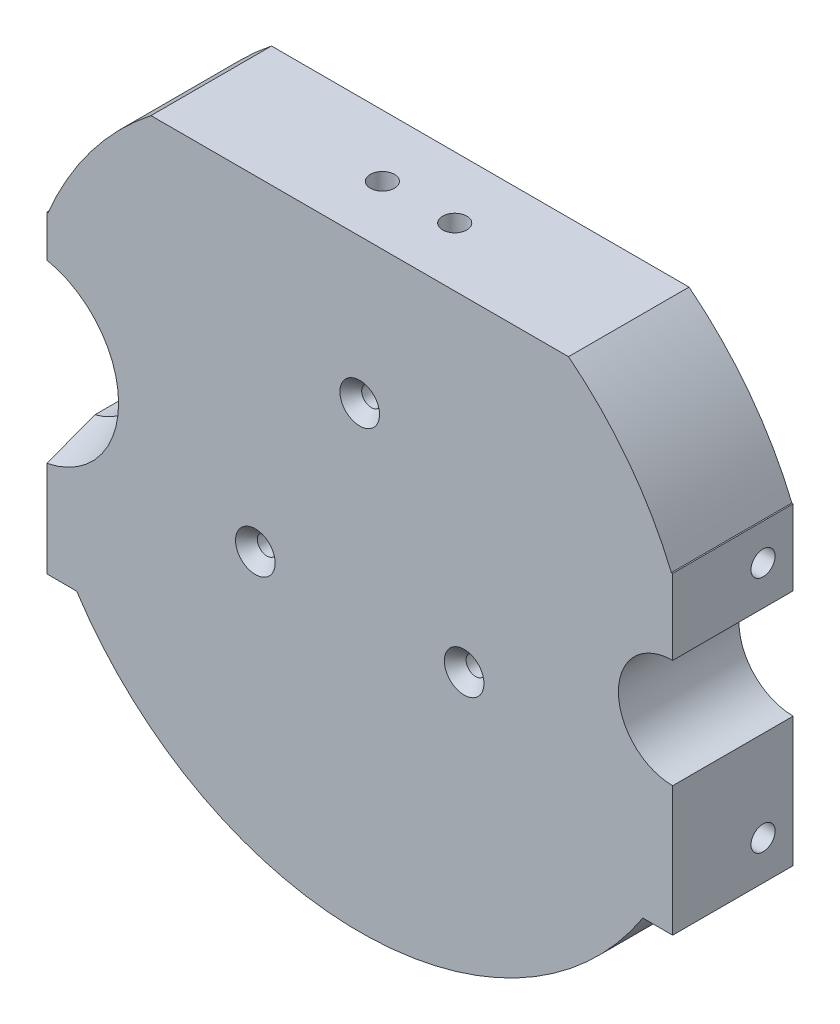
SolidWorks part; units mm, degrees
ref_plane "Front Plane" through (0, 0, 0) normal (0, 0, 1) x (1, 0, 0)
ref_plane "Top Plane" through (0, 0, 0) normal (0, 1, 0) x (1, 0, 0)
ref_plane "Right Plane" through (0, 0, 0) normal (1, 0, 0) x (0, 0, -1)
sketch "Sketch2" plane through (0, 0, 0) normal (0, 0, 1) x (1, 0, 0)
  line L0 (0, 0) -> (0, 82.931) construction
  line L1 (-82.423, -18.4451) -> (-82.423, -48.4124)
  line L2 (-82.423, 34.1376) -> (-82.0843, 34.1376)
  line L4 (91.948, -48.7934) -> (91.948, 34.1376) construction
  line L5 (82.0843, 34.1376) -> (82.423, 34.1376)
  line L6 (-91.948, -48.7934) -> (-91.948, 34.1376) construction
  line L7 (82.423, -14.3002) -> (82.423, -48.4124)
  line L9 (82.423, 34.1376) -> (82.423, 14.2748)
  line L10 (82.423, -48.4124) -> (74.5617, -48.4124)
  line L11 (-82.423, -48.4124) -> (-74.5617, -48.4124)
  line L12 (-82.423, 34.1376) -> (-82.423, 18.4451)
  arc A0 (82.0843, 34.1376) -> (-82.0843, 34.1376) centre (0, 0) ccw
  arc A1 (82.423, 14.2748) -> (82.423, -14.3002) centre (82.423, -0.0127) ccw
  arc A2 (-74.5617, -48.4124) -> (74.5617, -48.4124) centre (0, 0) ccw
  arc A3 (-82.423, -18.4451) -> (-82.423, 18.4451) centre (-87.1855, 0) ccw
  dimension "D4" = 177.8
  dimension "D7" = 14.2875
  dimension "D14" = 19.05
  dimension "D2" = 164.846
  dimension "D3" = 19.8628
  dimension "D5" = 34.1376
  dimension "D6" = 183.896
  dimension "D8" = 48.4124
  dimension "D9" = 82.423
  dimension "D10" = 82.423
  dimension "D11" = 91.948
  dimension "D12" = 91.948
  dimension "D13" = 82.55
  dimension "D15" = 87.1855
  dimension "D16" = 68.1355
  dimension "D17" = 68.1355
extrude "Boss-Extrude1" add sketch "Sketch2" against normal blind 31.75
hole_wizard "1/4 (0.25) Diameter Hole1" positions "Sketch11" profile "Sketch10" hole size "1/4" standard "ANSI Inch"
sketch "Sketch11" plane through (82.423, 0, 0) normal (1, 0, 0) x (0, 0, -1)
  line L0 (31.75, 34.1376) -> (0, 34.1376) construction
  line L2 (31.75, 34.1376) -> (31.75, 18.4451) construction
  line L3 (31.75, -48.4124) -> (0, -48.4124) construction
  point P0 (23.8125, 24.6126)
  point P4 (23.8125, -38.1)
  dimension "D1" = 7.9375
  dimension "D2" = 9.525
  dimension "D3" = 24.6126
  dimension "D4" = 62.7126
  dimension "D5" = 38.1
  dimension "D6" = 10.3124
sketch "Sketch10" plane through (82.423, 24.6126, -23.8125) normal (0, 1, 0) x (0, 0, -1)
  line L0 (0, 0) -> (0, 11.4327)
  line L1 (0, 11.4327) -> (3.175, 9.525)
  line L2 (3.175, 9.525) -> (3.175, 0)
  line L5 (3.175, 0) -> (0, 0)
  line L10 (0, 11.4327) -> (-3.175, 9.525) construction
  line L11 (0, -6.35) -> (0, 107.95) construction
  dimension "Hole Dia." = 6.35
  dimension "Hole Depth" = 9.525
  dimension "Drill Angle" = 118
hole_wizard "1/4 (0.25) Diameter Hole2" positions "Sketch13" profile "Sketch12" hole size "1/4" standard "ANSI Inch"
sketch "Sketch13" plane through (-82.423, 0, 0) normal (-1, 0, 0) x (0, 0, 1)
  line L1 (-31.75, 34.1376) -> (0, 34.1376) construction
  line L3 (-31.75, 34.1376) -> (-31.75, 18.4451) construction
  point P0 (-23.8125, -38.1)
  point P4 (-23.8125, 24.6126)
  dimension "D1" = 7.9375
  dimension "D2" = 62.7126
  dimension "D3" = 9.525
  dimension "D4" = 24.6126
  dimension "D5" = 38.1
sketch "Sketch12" plane through (-82.423, -38.1, -23.8125) normal (0, 1, 0) x (0, 0, 1)
  line L0 (0, 0) -> (0, 11.4327)
  line L1 (0, 11.4327) -> (3.175, 9.525)
  line L2 (3.175, 9.525) -> (3.175, 0)
  line L5 (3.175, 0) -> (0, 0)
  line L10 (0, 11.4327) -> (-3.175, 9.525) construction
  line L11 (0, -6.35) -> (0, 107.95) construction
  dimension "Hole Dia." = 6.35
  dimension "Hole Depth" = 9.525
  dimension "Drill Angle" = 118
sketch "Sketch18" plane through (0, 0, 0) normal (0, 0, 1) x (1, 0, 0)
  line L1 (127.4757, 125.8762) -> (-131.9061, 125.8762)
  line L2 (127.4757, 125.8762) -> (127.4757, 69.85)
  line L3 (127.4757, 69.85) -> (-131.9061, 69.85)
  line L4 (-131.9061, 125.8762) -> (-131.9061, 69.85)
  dimension "D1" = 69.85
extrude "Cut-Extrude4" cut sketch "Sketch18" against normal through all
sketch "Sketch19" plane through (0, 0, 0) normal (0, 1, 0) x (1, 0, 0)
  line L0 (0, 3.175) -> (-38.1, 3.175)
  line L1 (0, 3.175) -> (38.1, 3.175)
  line L2 (0, 3.175) -> (0, 0) construction
  line L3 (-38.1, 3.175) -> (-82.423, 0)
  line L4 (38.1, 3.175) -> (82.423, 0)
  line L5 (82.423, 0) -> (-82.423, 0)
  line L6 (-54.9926, 31.75) -> (54.9926, 31.75) construction
  line L7 (82.423, 0) -> (82.0843, 0) construction
  dimension "D1" = 38.1
  dimension "D2" = 164.846
  dimension "D3" = 3.175
  dimension "D4" = 28.575
hole_wizard "CSK for #10 Flat Head Socket Cap Screw1" positions "Sketch9" profile "Sketch8" countersink size "#10" standard "ANSI Inch"
sketch "Sketch9" plane through (64.8696, 88.3231, 0) normal (0, 0, 1) x (1, 0, 0)
  line L3 (-64.8696, -88.3231) -> (-64.8696, -56.5731) construction
  line L4 (-64.8696, -88.3231) -> (-37.3733, -104.1981) construction
  line L5 (-64.8696, -88.3231) -> (-92.3659, -104.1981) construction
  circle A1 centre (-64.8696, -88.3231) radius 31.75 construction
  point P9 (-64.8696, -56.5731)
  point P11 (-37.3733, -104.1981)
  point P46 (-92.3659, -104.1981)
  dimension "D1" = 31.75
  dimension "D3" = 120
  dimension "D2" = 120
sketch "Sketch8" plane through (0, 31.75, 0) normal (1, 0, 0) x (0, -1, 0)
  line L0 (0, 0) -> (0, 31.75)
  line L1 (0, 31.75) -> (2.5527, 31.75)
  line L2 (2.5527, 31.75) -> (2.5527, 3.068)
  line L3 (2.5527, 3.068) -> (5.2197, 0)
  line L5 (5.2197, 0) -> (0, 0)
  line L6 (-2.5527, 3.068) -> (-5.2197, 0) construction
  line L11 (0, -6.35) -> (0, 107.95) construction
  dimension "Thru Hole Dia." = 5.1054
  dimension "Thru Hole Depth" = 31.75
  dimension "Near C'Sink Dia." = 10.4394
  dimension "Near C'Sink Angle" = 82
sketch "Sketch16" plane through (0, 0, -31.75) normal (0, 0, -1) x (-1, 0, 0)
  circle A0 centre (0, 0) radius 37.3126
  dimension "D1" = 74.6252
extrude "Cut-Extrude2" [suppressed] cut sketch "Sketch16" against normal blind 6.35
sketch "Sketch15" [suppressed] plane through (0, 0, -28.575) normal (0, 0, -1) x (-1, 0, 0)
  line L0 (-25.4, -27.3326) -> (25.4, -27.3326) construction
  line L1 (0, -27.3326) -> (0, 0) construction
  line L5 (-25.4, -140.0451) -> (25.4, -140.0451)
  line L6 (-25.4, -140.0451) -> (-25.4, -25.7451)
  line L7 (-25.4, -25.7451) -> (25.4, -25.7451)
  line L8 (25.4, -25.7451) -> (25.4, -140.0451)
  circle A2 centre (0, 0) radius 37.3126 construction
  dimension "D1" = 25.7451
  dimension "D2" = 112.7125
  dimension "D3" = 50.8
  dimension "D5" = 1.5875
extrude "Cut-Extrude1" [suppressed] cut sketch "Sketch15" against normal up to surface (22.225 mm away)
sketch "Sketch17" [suppressed] plane through (0, 0, -28.575) normal (0, 0, -1) x (-1, 0, 0)
  line L2 (-25.4, -66.675) -> (25.4, -66.675)
  line L4 (-25.4, -27.3326) -> (-25.4, -130.1)
  line L5 (25.4, -130.1) -> (25.4, -27.3326)
  line L6 (-25.4, -66.675) -> (-25.4, -130.1)
  line L7 (25.4, -130.1) -> (25.4, -66.675)
  arc A4 (25.4, -27.3326) -> (-25.4, -27.3326) centre (0, 0) ccw
  arc A5 (-25.4, -130.1) -> (25.4, -130.1) centre (0, 0) ccw
  arc A7 (-25.4, -130.1) -> (25.4, -130.1) centre (0, 0) ccw
  dimension "D2" = 66.675
  dimension "D1" = 0
extrude "Cut-Extrude3" [suppressed] cut sketch "Sketch17" against normal through all
hole_wizard "CSK for 1/4 Flat Head Machine Screw1" positions "Sketch23" profile "Sketch22" countersink size "1/4" standard "ANSI Inch"
sketch "Sketch23" [suppressed] plane through (0, 0, -63.5) normal (0, 0, -1) x (-1, 0, 0)
  point P0 (-22.225, -26.035)
  point P3 (22.225, -26.035)
  point P8 (-22.225, -102.235)
  point P13 (22.225, -102.235)
sketch "Sketch22" plane through (22.225, -26.035, -63.5) normal (1, 0, 0) x (0, 1, 0)
  line L0 (0, 0) -> (0, 63.5)
  line L1 (0, 63.5) -> (3.3782, 63.5)
  line L2 (3.3782, 63.5) -> (3.3782, 3.5209)
  line L3 (3.3782, 3.5209) -> (6.4389, 0)
  line L5 (6.4389, 0) -> (0, 0)
  line L6 (-3.3782, 3.5209) -> (-6.4389, 0) construction
  line L11 (0, -6.35) -> (0, 107.95) construction
  dimension "Thru Hole Dia." = 6.7564
  dimension "Thru Hole Depth" = 63.5
  dimension "Near C'Sink Dia." = 12.8778
  dimension "Near C'Sink Angle" = 82
hole_wizard "CSK for 1/4 Flat Head Machine Screw3" positions "Sketch29" profile "Sketch28" countersink size "1/4" standard "ANSI Inch"
sketch "Sketch29" [suppressed] plane through (0, 0, -31.75) normal (0, 0, -1) x (-1, 0, 0)
  point P0 (-22.225, 24.6062)
  point P3 (22.225, 24.6062)
  point P6 (22.225, 100.8062)
  point P9 (-22.225, 100.8062)
sketch "Sketch28" plane through (22.225, 24.6062, -31.75) normal (1, 0, 0) x (0, 1, 0)
  line L0 (0, 0) -> (0, 31.75)
  line L1 (0, 31.75) -> (3.3782, 31.75)
  line L2 (3.3782, 31.75) -> (3.3782, 3.5209)
  line L3 (3.3782, 3.5209) -> (6.4389, 0)
  line L5 (6.4389, 0) -> (0, 0)
  line L6 (-3.3782, 3.5209) -> (-6.4389, 0) construction
  line L11 (0, -6.35) -> (0, 107.95) construction
  dimension "Thru Hole Dia." = 6.7564
  dimension "Thru Hole Depth" = 31.75
  dimension "Near C'Sink Dia." = 12.8778
  dimension "Near C'Sink Angle" = 82
hole_wizard "1/4 (0.25) Diameter Hole3" positions "Sketch32" profile "Sketch31" hole size "1/4" standard "ANSI Inch"
sketch "Sketch32" plane through (0, 69.85, 0) normal (0, 1, 0) x (1, 0, 0)
  line L1 (-54.9926, 31.75) -> (54.9926, 31.75) construction
  line L2 (0, 3.175) -> (0, 0) construction
  point P0 (-9.525, 15.494)
  point P1 (9.525, 15.494)
  dimension "D1" = 15.494
  dimension "D2" = 16.256
  dimension "D3" = 9.525
  dimension "D4" = 9.525
sketch "Sketch31" plane through (-9.525, 69.85, -15.494) normal (1, 0, 0) x (0, 0, 1)
  line L0 (0, 0) -> (0, 11.4327)
  line L1 (0, 11.4327) -> (3.175, 9.525)
  line L2 (3.175, 9.525) -> (3.175, 0)
  line L5 (3.175, 0) -> (0, 0)
  line L10 (0, 11.4327) -> (-3.175, 9.525) construction
  line L11 (0, -6.35) -> (0, 107.95) construction
  dimension "Hole Dia." = 6.35
  dimension "Hole Depth" = 9.525
  dimension "Drill Angle" = 118
chamfer "Chamfer1" distance 12.7 angle 20 1 edges at (-68.1355, 0, 0)
equation "\"Buoyancy\"= \"SW-Volume\" * ( \"SW-Density\" - .037062 )"
